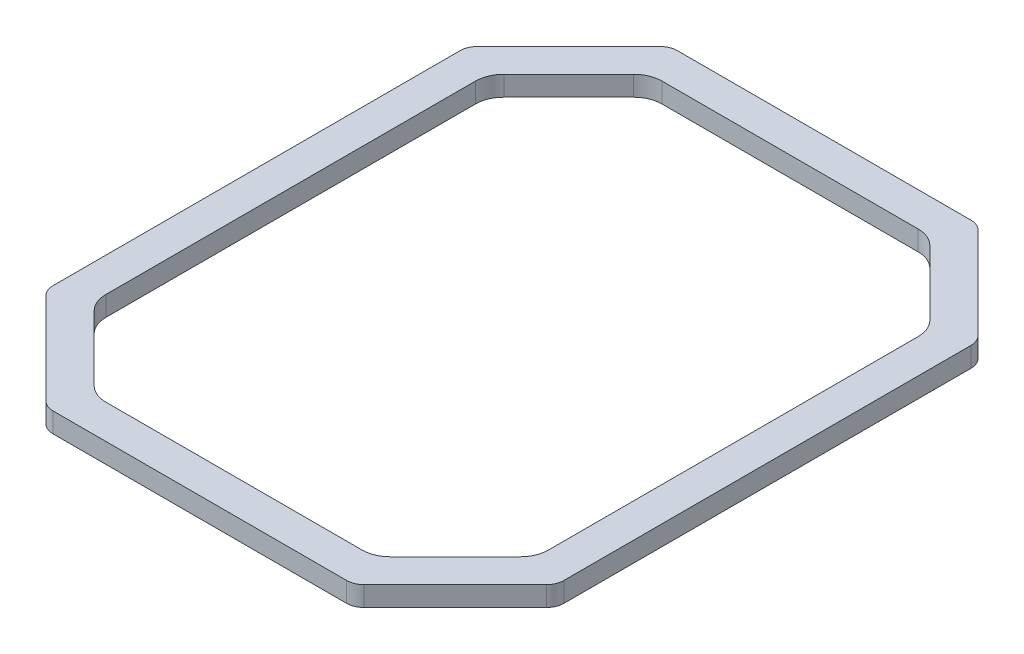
SolidWorks part; units mm, degrees
ref_plane "Front Plane" through (0, 0, 0) normal (0, 0, 1) x (1, 0, 0)
ref_plane "Top Plane" through (0, 0, 0) normal (0, 1, 0) x (1, 0, 0)
ref_plane "Right Plane" through (0, 0, 0) normal (1, 0, 0) x (0, 0, -1)
sketch "Sketch1" plane through (-905.7837, 0, -1752.4807) normal (0, 1, 0) x (1, 0, 0)
  line L0 (5.8681, -21.2898) -> (-2.1929, -29.3508)
  line L1 (-2.6323, -30.4115) -> (-2.6323, -66.2894)
  line L2 (-2.1929, -67.3501) -> (5.8681, -75.4111)
  line L3 (6.9288, -75.8505) -> (32.8067, -75.8505)
  line L4 (33.8674, -75.4111) -> (41.9284, -67.3501)
  line L5 (42.3677, -66.2894) -> (42.3677, -30.4115)
  line L6 (41.9284, -29.3508) -> (33.8674, -21.2898)
  line L7 (32.8067, -20.8505) -> (6.9288, -20.8505)
  line L8 (42.282, -28.9973) -> (34.2209, -20.9362)
  line L9 (32.8067, -20.3505) -> (6.9288, -20.3505)
  line L10 (5.5145, -20.9362) -> (-2.5465, -28.9973)
  line L11 (-3.1323, -30.4115) -> (-3.1323, -66.2894)
  line L12 (-2.5465, -67.7036) -> (5.5145, -75.7647)
  line L13 (6.9288, -76.3505) -> (32.8067, -76.3505)
  line L14 (34.2209, -75.7647) -> (42.282, -67.7036)
  line L15 (42.8677, -66.2894) -> (42.8677, -30.4115)
  line L16 (42.282, -28.9973) -> (34.2209, -20.9362) construction
  line L17 (32.8067, -20.3505) -> (6.9288, -20.3505) construction
  line L18 (5.5145, -20.9362) -> (-2.5465, -28.9973) construction
  line L19 (-3.1323, -30.4115) -> (-3.1323, -66.2894) construction
  line L20 (-2.5465, -67.7036) -> (5.5145, -75.7647) construction
  line L21 (6.9288, -76.3505) -> (32.8067, -76.3505) construction
  line L22 (34.2209, -75.7647) -> (42.282, -67.7036) construction
  line L23 (42.8677, -66.2894) -> (42.8677, -30.4115) construction
  line L24 (1.4535, -66.0468) -> (7.1714, -71.7647)
  line L25 (0.8677, -32.0683) -> (0.8677, -64.6326)
  line L26 (7.1714, -24.9362) -> (1.4535, -30.6541)
  line L27 (31.1499, -24.3505) -> (8.5856, -24.3505)
  line L28 (38.282, -30.6541) -> (32.5641, -24.9362)
  line L29 (38.8677, -64.6326) -> (38.8677, -32.0683)
  line L30 (32.5641, -71.7647) -> (38.282, -66.0468)
  line L31 (8.5856, -72.3505) -> (31.1499, -72.3505)
  line L32 (1.4535, -66.0468) -> (7.1714, -71.7647) construction
  line L33 (0.8677, -32.0683) -> (0.8677, -64.6326) construction
  line L34 (7.1714, -24.9362) -> (1.4535, -30.6541) construction
  line L35 (31.1499, -24.3505) -> (8.5856, -24.3505) construction
  line L36 (38.282, -30.6541) -> (32.5641, -24.9362) construction
  line L37 (38.8677, -64.6326) -> (38.8677, -32.0683) construction
  line L38 (32.5641, -71.7647) -> (38.282, -66.0468) construction
  line L39 (8.5856, -72.3505) -> (31.1499, -72.3505) construction
  line L40 (6.8178, -24.5827) -> (1.1, -30.3006)
  line L41 (0.3677, -32.0683) -> (0.3677, -64.6326)
  line L42 (1.1, -66.4003) -> (6.8178, -72.1182)
  line L43 (8.5856, -72.8505) -> (31.1499, -72.8505)
  line L44 (32.9176, -72.1182) -> (38.6355, -66.4003)
  line L45 (39.3677, -64.6326) -> (39.3677, -32.0683)
  line L46 (38.6355, -30.3006) -> (32.9176, -24.5827)
  line L47 (31.1499, -23.8505) -> (8.5856, -23.8505)
  arc A0 (-2.1929, -29.3508) -> (-2.6323, -30.4115) centre (-1.1323, -30.4115) ccw
  arc A1 (-2.6323, -66.2894) -> (-2.1929, -67.3501) centre (-1.1323, -66.2894) ccw
  arc A2 (5.8681, -75.4111) -> (6.9288, -75.8505) centre (6.9288, -74.3505) ccw
  arc A3 (32.8067, -75.8505) -> (33.8674, -75.4111) centre (32.8067, -74.3505) ccw
  arc A4 (41.9284, -67.3501) -> (42.3677, -66.2894) centre (40.8677, -66.2894) ccw
  arc A5 (42.3677, -30.4115) -> (41.9284, -29.3508) centre (40.8677, -30.4115) ccw
  arc A6 (33.8674, -21.2898) -> (32.8067, -20.8505) centre (32.8067, -22.3505) ccw
  arc A7 (6.9288, -20.8505) -> (5.8681, -21.2898) centre (6.9288, -22.3505) ccw
  arc A8 (34.2209, -20.9362) -> (32.8067, -20.3505) centre (32.8067, -22.3505) ccw
  arc A9 (6.9288, -20.3505) -> (5.5145, -20.9362) centre (6.9288, -22.3505) ccw
  arc A10 (-2.5465, -28.9973) -> (-3.1323, -30.4115) centre (-1.1323, -30.4115) ccw
  arc A11 (-3.1323, -66.2894) -> (-2.5465, -67.7036) centre (-1.1323, -66.2894) ccw
  arc A12 (5.5145, -75.7647) -> (6.9288, -76.3505) centre (6.9288, -74.3505) ccw
  arc A13 (32.8067, -76.3505) -> (34.2209, -75.7647) centre (32.8067, -74.3505) ccw
  arc A14 (42.282, -67.7036) -> (42.8677, -66.2894) centre (40.8677, -66.2894) ccw
  arc A15 (42.8677, -30.4115) -> (42.282, -28.9973) centre (40.8677, -30.4115) ccw
  arc A16 (34.2209, -20.9362) -> (32.8067, -20.3505) centre (32.8067, -22.3505) ccw construction
  arc A17 (6.9288, -20.3505) -> (5.5145, -20.9362) centre (6.9288, -22.3505) ccw construction
  arc A18 (-2.5465, -28.9973) -> (-3.1323, -30.4115) centre (-1.1323, -30.4115) ccw construction
  arc A19 (-3.1323, -66.2894) -> (-2.5465, -67.7036) centre (-1.1323, -66.2894) ccw construction
  arc A20 (5.5145, -75.7647) -> (6.9288, -76.3505) centre (6.9288, -74.3505) ccw construction
  arc A21 (32.8067, -76.3505) -> (34.2209, -75.7647) centre (32.8067, -74.3505) ccw construction
  arc A22 (42.282, -67.7036) -> (42.8677, -66.2894) centre (40.8677, -66.2894) ccw construction
  arc A23 (42.8677, -30.4115) -> (42.282, -28.9973) centre (40.8677, -30.4115) ccw construction
  arc A24 (0.8677, -64.6326) -> (1.4535, -66.0468) centre (2.8677, -64.6326) ccw
  arc A25 (1.4535, -30.6541) -> (0.8677, -32.0683) centre (2.8677, -32.0683) ccw
  arc A26 (8.5856, -24.3505) -> (7.1714, -24.9362) centre (8.5856, -26.3505) ccw
  arc A27 (32.5641, -24.9362) -> (31.1499, -24.3505) centre (31.1499, -26.3505) ccw
  arc A28 (38.8677, -32.0683) -> (38.282, -30.6541) centre (36.8677, -32.0683) ccw
  arc A29 (38.282, -66.0468) -> (38.8677, -64.6326) centre (36.8677, -64.6326) ccw
  arc A30 (31.1499, -72.3505) -> (32.5641, -71.7647) centre (31.1499, -70.3505) ccw
  arc A31 (7.1714, -71.7647) -> (8.5856, -72.3505) centre (8.5856, -70.3505) ccw
  arc A32 (0.8677, -64.6326) -> (1.4535, -66.0468) centre (2.8677, -64.6326) ccw construction
  arc A33 (1.4535, -30.6541) -> (0.8677, -32.0683) centre (2.8677, -32.0683) ccw construction
  arc A34 (8.5856, -24.3505) -> (7.1714, -24.9362) centre (8.5856, -26.3505) ccw construction
  arc A35 (32.5641, -24.9362) -> (31.1499, -24.3505) centre (31.1499, -26.3505) ccw construction
  arc A36 (38.8677, -32.0683) -> (38.282, -30.6541) centre (36.8677, -32.0683) ccw construction
  arc A37 (38.282, -66.0468) -> (38.8677, -64.6326) centre (36.8677, -64.6326) ccw construction
  arc A38 (31.1499, -72.3505) -> (32.5641, -71.7647) centre (31.1499, -70.3505) ccw construction
  arc A39 (7.1714, -71.7647) -> (8.5856, -72.3505) centre (8.5856, -70.3505) ccw construction
  arc A40 (1.1, -30.3006) -> (0.3677, -32.0683) centre (2.8677, -32.0683) ccw
  arc A41 (0.3677, -64.6326) -> (1.1, -66.4003) centre (2.8677, -64.6326) ccw
  arc A42 (6.8178, -72.1182) -> (8.5856, -72.8505) centre (8.5856, -70.3505) ccw
  arc A43 (31.1499, -72.8505) -> (32.9176, -72.1182) centre (31.1499, -70.3505) ccw
  arc A44 (38.6355, -66.4003) -> (39.3677, -64.6326) centre (36.8677, -64.6326) ccw
  arc A45 (39.3677, -32.0683) -> (38.6355, -30.3006) centre (36.8677, -32.0683) ccw
  arc A46 (32.9176, -24.5827) -> (31.1499, -23.8505) centre (31.1499, -26.3505) ccw
  arc A47 (8.5856, -23.8505) -> (6.8178, -24.5827) centre (8.5856, -26.3505) ccw
  dimension "D1" = 0
  dimension "D2" = 0
  dimension "D3" = 0.5
  dimension "D4" = 0.5
extrude "Boss-Extrude1" add sketch "Sketch1" along normal blind 1.75
